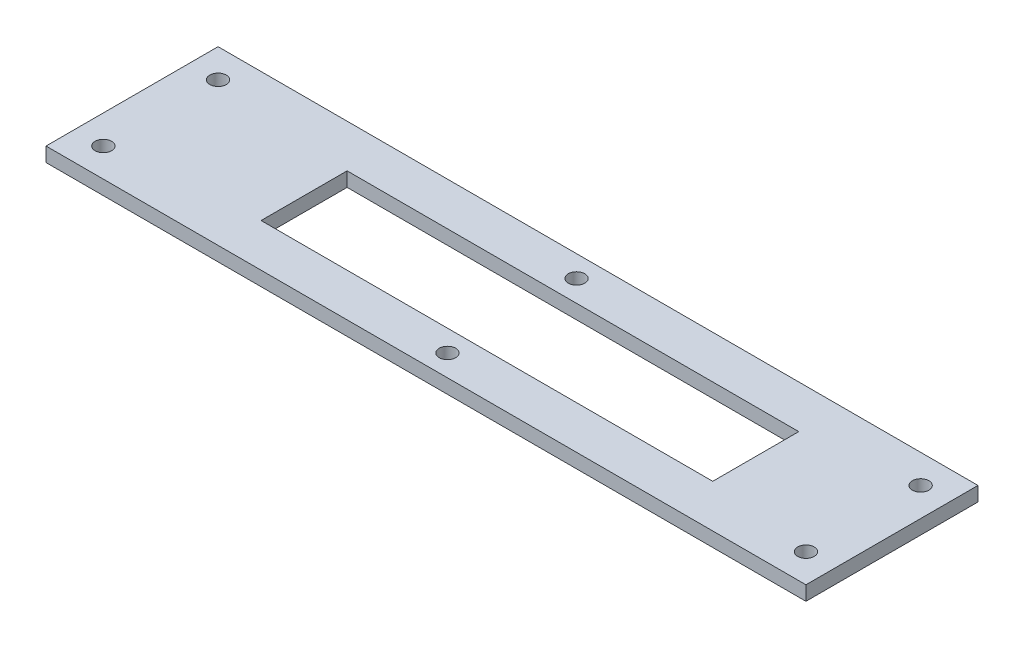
SolidWorks part; units mm, degrees
ref_plane "Front Plane" through (0, 0, 0) normal (0, 0, 1) x (1, 0, 0)
ref_plane "Top Plane" through (0, 0, 0) normal (0, 1, 0) x (1, 0, 0)
ref_plane "Right Plane" through (0, 0, 0) normal (1, 0, 0) x (0, 0, -1)
sketch "Sketch1" plane through (0, 0, 0) normal (0, 1, 0) x (1, 0, 0)
  line L0 (-53.5, 12) -> (-53.5, -12)
  line L1 (52.5, -12) -> (-53.5, -12)
  line L2 (52.5, -12) -> (52.5, 12)
  line L3 (52.5, 12) -> (-53.5, 12)
  line L5 (-29.5, 6) -> (33.5, 6)
  line L6 (-29.5, 6) -> (-29.5, -6)
  line L7 (-29.5, -6) -> (33.5, -6)
  line L8 (33.5, 6) -> (33.5, -6)
  circle A4 centre (-49.5, 8) radius 1.15
  circle A5 centre (-49.5, -8) radius 1.15
  circle A6 centre (48.5, -8) radius 1.15
  circle A7 centre (48.5, 8) radius 1.15
  circle A10 centre (-0.5, -9) radius 1.15
  circle A11 centre (-0.5, 9) radius 1.15
  dimension "D3" = 6
  dimension "D4" = 4
  dimension "D5" = 4
  dimension "D1" = 4
  dimension "D12" = 3
  dimension "D2" = 6
  dimension "D6" = 4
  dimension "D8" = 4
  dimension "D9" = 4
  dimension "D10" = 4
  dimension "D11" = 4
  dimension "D13" = 3
extrude "Boss-Extrude1" add sketch "Sketch1" along normal blind 2
